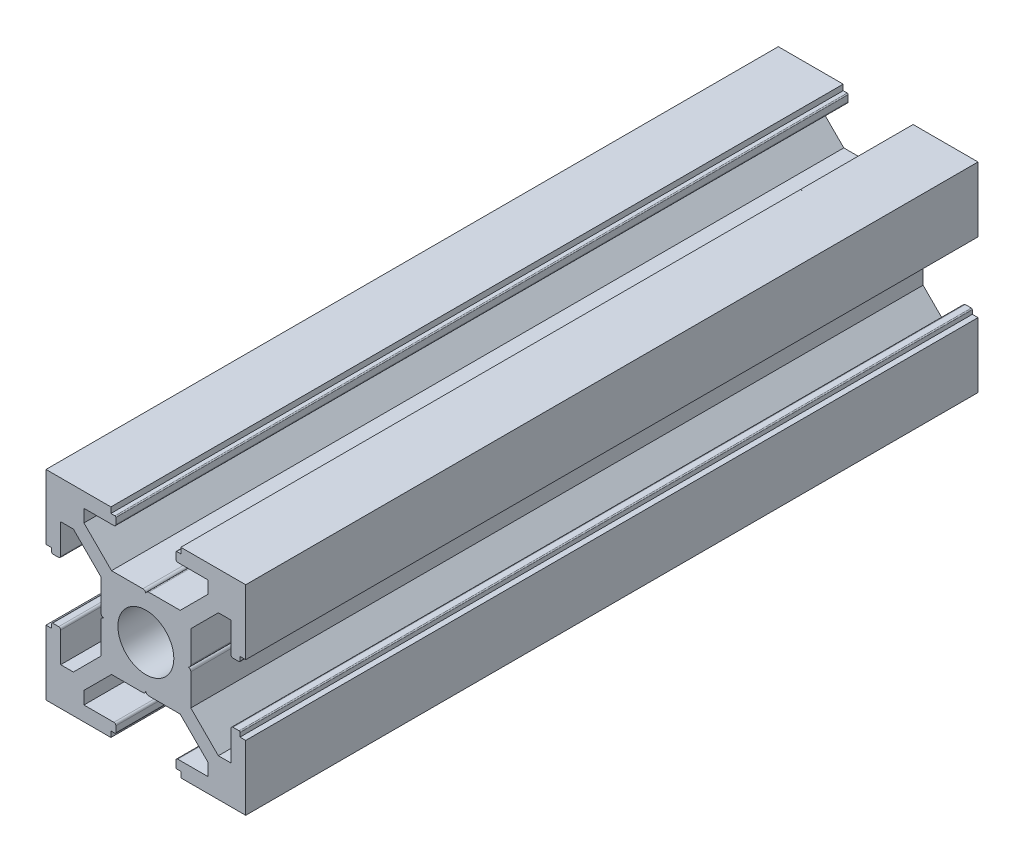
SolidWorks part; units mm, degrees
ref_plane "Alzado" through (0, 0, 0) normal (0, 0, 1) x (1, 0, 0)
ref_plane "Planta" through (0, 0, 0) normal (0, 1, 0) x (1, 0, 0)
ref_plane "Vista lateral" through (0, 0, 0) normal (1, 0, 0) x (0, 0, -1)
sketch "Croquis1" plane through (0, 0, 0) normal (0, 0, 1) x (1, 0, 0)
  line L0 (-15, 15) -> (-5.25, 15)
  line L1 (6.7045, 8.2955) -> (5.159, 6.75)
  line L8 (15, 15) -> (5.25, 15)
  line L10 (-5.25, 12.795) -> (-4.5, 12.795) construction
  line L11 (-4.5, 12.795) -> (-4.5, 14.145) construction
  line L12 (-4.65, 14.145) -> (-5.25, 14.145)
  line L13 (-5.25, 14.145) -> (-5.25, 15)
  line L15 (-9.3, 12.795) -> (-4.8, 12.795)
  line L16 (-4.5, 13.095) -> (-4.5, 13.995)
  line L20 (-9.3, 12.795) -> (-9.3, 10.891)
  line L21 (-9.3, 10.891) -> (-6.7045, 8.2955)
  line L22 (-6.7045, 8.2955) -> (-5.159, 6.75)
  line L23 (-8.2955, 6.7045) -> (-6.75, 5.159)
  line L24 (-10.891, 9.3) -> (-8.2955, 6.7045)
  line L25 (-12.795, 9.3) -> (-10.891, 9.3)
  line L26 (-12.795, 9.3) -> (-12.795, 4.8)
  line L27 (-13.095, 4.5) -> (-13.995, 4.5)
  line L28 (-14.145, 4.65) -> (-14.145, 5.25)
  line L29 (-14.145, 5.25) -> (-15, 5.25)
  line L30 (-15, 15) -> (-15, 5.25)
  line L31 (-15, -15) -> (-15, -5.25)
  line L32 (-14.145, -5.25) -> (-15, -5.25)
  line L33 (-14.145, -4.65) -> (-14.145, -5.25)
  line L34 (-13.095, -4.5) -> (-13.995, -4.5)
  line L35 (-12.795, -9.3) -> (-12.795, -4.8)
  line L36 (-12.795, -9.3) -> (-10.891, -9.3)
  line L37 (-10.891, -9.3) -> (-8.2955, -6.7045)
  line L38 (-8.2955, -6.7045) -> (-6.75, -5.159)
  line L39 (-6.7045, -8.2955) -> (-5.159, -6.75)
  line L40 (-9.3, -10.891) -> (-6.7045, -8.2955)
  line L41 (-9.3, -12.795) -> (-9.3, -10.891)
  line L42 (-9.3, -12.795) -> (-4.8, -12.795)
  line L43 (-4.5, -13.095) -> (-4.5, -13.995)
  line L44 (-4.65, -14.145) -> (-5.25, -14.145)
  line L45 (-5.25, -14.145) -> (-5.25, -15)
  line L46 (-15, -15) -> (-5.25, -15)
  line L47 (6.7045, -8.2955) -> (5.159, -6.75)
  line L51 (4.5, 12.795) -> (4.5, 14.145) construction
  line L52 (5.25, 12.795) -> (4.5, 12.795) construction
  line L55 (15, -15) -> (5.25, -15)
  line L56 (5.25, -14.145) -> (5.25, -15)
  line L57 (4.65, -14.145) -> (5.25, -14.145)
  line L58 (4.5, -13.095) -> (4.5, -13.995)
  line L59 (9.3, -12.795) -> (4.8, -12.795)
  line L60 (9.3, -12.795) -> (9.3, -10.891)
  line L61 (9.3, -10.891) -> (6.7045, -8.2955)
  line L62 (8.2955, -6.7045) -> (6.75, -5.159)
  line L63 (10.891, -9.3) -> (8.2955, -6.7045)
  line L64 (12.795, -9.3) -> (10.891, -9.3)
  line L65 (12.795, -9.3) -> (12.795, -4.8)
  line L66 (13.095, -4.5) -> (13.995, -4.5)
  line L67 (14.145, -4.65) -> (14.145, -5.25)
  line L68 (14.145, -5.25) -> (15, -5.25)
  line L69 (15, -15) -> (15, -5.25)
  line L70 (15, 15) -> (15, 5.25)
  line L71 (14.145, 5.25) -> (15, 5.25)
  line L72 (14.145, 4.65) -> (14.145, 5.25)
  line L73 (13.095, 4.5) -> (13.995, 4.5)
  line L74 (12.795, 9.3) -> (12.795, 4.8)
  line L75 (12.795, 9.3) -> (10.891, 9.3)
  line L76 (10.891, 9.3) -> (8.2955, 6.7045)
  line L77 (8.2955, 6.7045) -> (6.75, 5.159)
  line L78 (9.3, 10.891) -> (6.7045, 8.2955)
  line L79 (9.3, 12.795) -> (9.3, 10.891)
  line L80 (4.5, 13.095) -> (4.5, 13.995)
  line L81 (9.3, 12.795) -> (4.8, 12.795)
  line L82 (5.25, 14.145) -> (5.25, 15)
  line L83 (4.65, 14.145) -> (5.25, 14.145)
  line L84 (15, 15) -> (5.25, 15)
  line L87 (6.75, 0.45) -> (6.75, 5.159)
  line L88 (6.75, -0.45) -> (6.75, -5.159)
  line L89 (6.3, 0) -> (6.75, 0) construction
  line L90 (-6.75, -0.45) -> (-6.75, -5.159)
  line L91 (-6.75, 0.45) -> (-6.75, 5.159)
  line L94 (5.159, 6.75) -> (0.45, 6.75)
  line L95 (-5.159, 6.75) -> (-0.45, 6.75)
  line L96 (5.159, -6.75) -> (0.45, -6.75)
  line L97 (-5.159, -6.75) -> (-0.45, -6.75)
  arc A0 (-4.5, 13.995) -> (-4.65, 14.145) centre (-4.65, 13.995) ccw
  arc A1 (-4.8, 12.795) -> (-4.5, 13.095) centre (-4.8, 13.095) ccw
  arc A2 (-12.795, 4.8) -> (-13.095, 4.5) centre (-13.095, 4.8) cw
  arc A3 (-13.995, 4.5) -> (-14.145, 4.65) centre (-13.995, 4.65) cw
  arc A4 (-13.995, -4.5) -> (-14.145, -4.65) centre (-13.995, -4.65) ccw
  arc A5 (-12.795, -4.8) -> (-13.095, -4.5) centre (-13.095, -4.8) ccw
  arc A6 (-4.8, -12.795) -> (-4.5, -13.095) centre (-4.8, -13.095) cw
  arc A7 (-4.5, -13.995) -> (-4.65, -14.145) centre (-4.65, -13.995) cw
  arc A8 (4.5, -13.995) -> (4.65, -14.145) centre (4.65, -13.995) ccw
  arc A9 (4.8, -12.795) -> (4.5, -13.095) centre (4.8, -13.095) ccw
  arc A10 (12.795, -4.8) -> (13.095, -4.5) centre (13.095, -4.8) cw
  arc A11 (13.995, -4.5) -> (14.145, -4.65) centre (13.995, -4.65) cw
  arc A12 (13.995, 4.5) -> (14.145, 4.65) centre (13.995, 4.65) ccw
  arc A13 (12.795, 4.8) -> (13.095, 4.5) centre (13.095, 4.8) ccw
  arc A14 (4.8, 12.795) -> (4.5, 13.095) centre (4.8, 13.095) cw
  arc A15 (4.5, 13.995) -> (4.65, 14.145) centre (4.65, 13.995) cw
  circle A16 centre (0, 0) radius 4.2
  arc A17 (6.75, 0.45) -> (6.3, 0) centre (6.3, 0.45) cw
  arc A18 (6.75, -0.45) -> (6.3, 0) centre (6.3, -0.45) ccw
  arc A19 (-6.75, -0.45) -> (-6.3, 0) centre (-6.3, -0.45) cw
  arc A20 (-6.75, 0.45) -> (-6.3, 0) centre (-6.3, 0.45) ccw
  arc A21 (-0.45, 6.75) -> (0, 6.3) centre (-0.45, 6.3) cw
  arc A22 (0.45, 6.75) -> (0, 6.3) centre (0.45, 6.3) ccw
  arc A23 (-0.45, -6.75) -> (0, -6.3) centre (-0.45, -6.3) ccw
  arc A24 (0.45, -6.75) -> (0, -6.3) centre (0.45, -6.3) cw
  point P4 (15, 0)
  point P5 (0, 15)
extrude "Extruir1" add sketch "Croquis1" along normal blind 110
